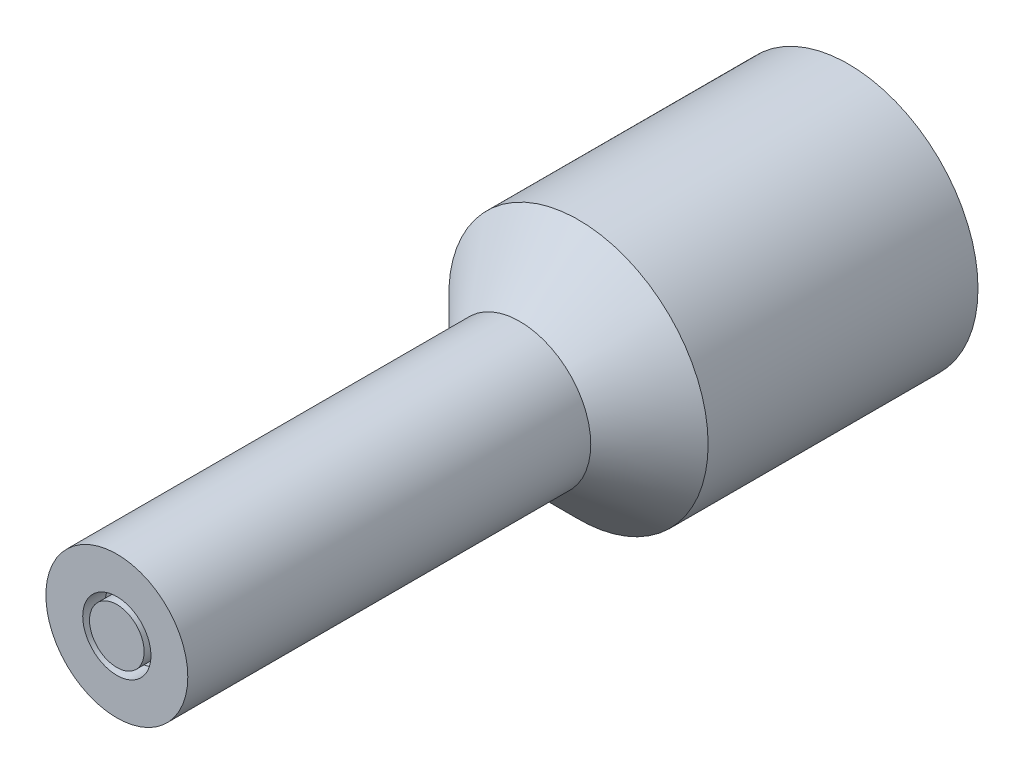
SolidWorks part; units mm, degrees
ref_plane "Front" through (0, 0, 0) normal (0, 0, 1) x (1, 0, 0)
ref_plane "Top" through (0, 0, 0) normal (0, 1, 0) x (1, 0, 0)
ref_plane "Right" through (0, 0, 0) normal (1, 0, 0) x (0, 0, -1)
sketch "Sketch1" plane through (0, 0, 0) normal (0, 0, 1) x (1, 0, 0)
  line L0 (0, 0) -> (-59.6027, 0) construction
sketch "Sketch2" plane through (0, 0, 0) normal (1, 0, 0) x (0, 0, -1)
  line L0 (0, 0) -> (41.9002, 0) construction
  line L1 (-81.5166, 16.51) -> (-175.26, 16.51) construction
  line L2 (-67.8641, 30.1625) -> (-81.5166, 16.51) construction
  line L3 (-5.08, 30.1625) -> (-67.8641, 30.1625) construction
  line L4 (-81.5166, 16.51) -> (-175.26, 16.51)
  line L5 (-67.8641, 30.1625) -> (-81.5166, 16.51)
  line L6 (-5.08, 30.1625) -> (-67.8641, 30.1625)
  line L7 (-5.08, 0) -> (-175.26, 0)
  line L8 (-175.26, 16.51) -> (-175.26, 0)
  line L9 (-5.08, 30.1625) -> (-5.08, 0)
revolve "Base-Revolve" add sketch "Sketch2" angle 360 about L0
other "Cavity1"
other "LINEAR ACTUATOR REWORK<1>@LINEAR ACTUATOR ASSEMBLY/LINEAR ACTUATOR<1>@LINEAR ACTUATOR REWORK"
other "LINEAR ACTUATOR REWORK<1>@LINEAR ACTUATOR ASSEMBLY/ROD ASSEMBLY<1>@LINEAR ACTUATOR REWORK/ROD END<1>@ROD ASSEMBLY"
other "LINEAR ACTUATOR REWORK<1>@LINEAR ACTUATOR ASSEMBLY/ROD ASSEMBLY<1>@LINEAR ACTUATOR REWORK/ROD<1>@ROD ASSEMBLY"
other "LINEAR ACTUATOR REWORK<1>@LINEAR ACTUATOR ASSEMBLY/STOP WASHER<2>@LINEAR ACTUATOR REWORK"
other "LINEAR ACTUATOR REWORK<1>@LINEAR ACTUATOR ASSEMBLY/BUMPER<1>@LINEAR ACTUATOR REWORK"
other "LINEAR ACTUATOR REWORK<1>@LINEAR ACTUATOR ASSEMBLY/ACME NUT<1>@LINEAR ACTUATOR REWORK"
other "LINEAR ACTUATOR REWORK<1>@LINEAR ACTUATOR ASSEMBLY/STOP WASHER<1>@LINEAR ACTUATOR REWORK"
other "LINEAR ACTUATOR REWORK<1>@LINEAR ACTUATOR ASSEMBLY/NUTS ANSI B18.6.3<1>@LINEAR ACTUATOR REWORK"
other "LINEAR ACTUATOR REWORK<1>@LINEAR ACTUATOR ASSEMBLY/ROD COVER<1>@LINEAR ACTUATOR REWORK"
